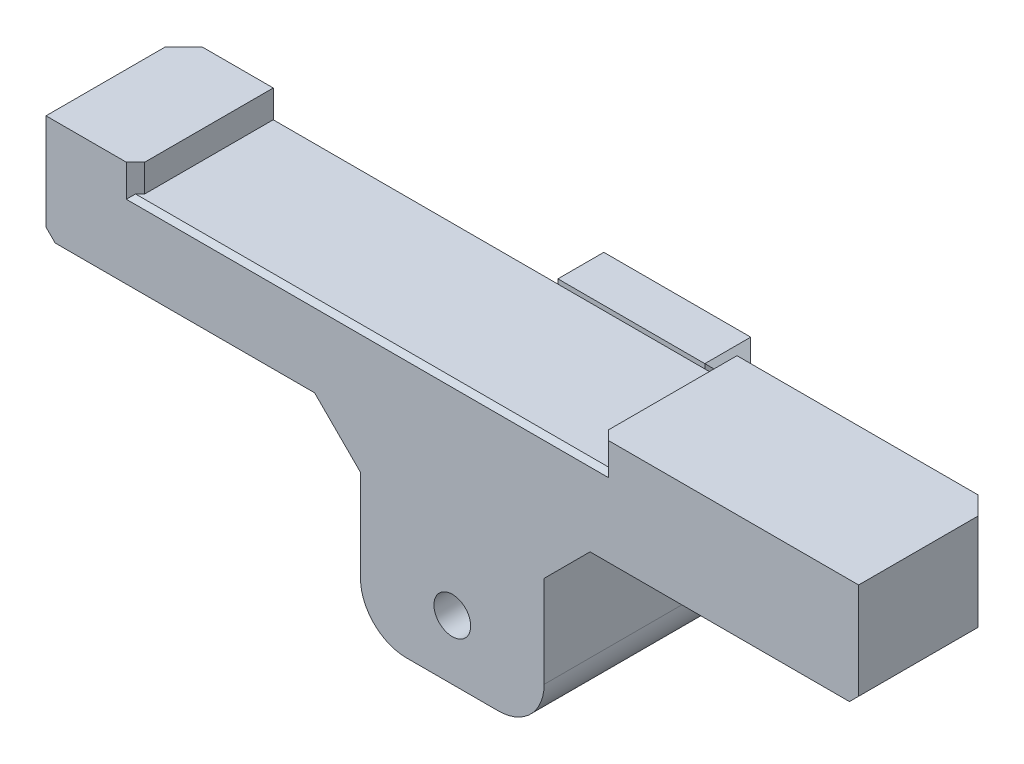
SolidWorks part; units mm, degrees
ref_plane "Ebene vorne" through (0, 0, 0) normal (0, 0, 1) x (1, 0, 0)
ref_plane "Ebene oben" through (0, 0, 0) normal (0, 1, 0) x (1, 0, 0)
ref_plane "Ebene rechts" through (0, 0, 0) normal (1, 0, 0) x (0, 0, -1)
sketch "Skizze1" plane through (0, 0, 0) normal (0, 0, 1) x (1, 0, 0)
  line L1 (-88.5, -11.5) -> (88.5, -11.5)
  line L2 (-88.5, -11.5) -> (-88.5, 11.5)
  line L3 (-88.5, 11.5) -> (88.5, 11.5)
  line L4 (88.5, -11.5) -> (88.5, 11.5)
  line L5 (-88.5, -11.5) -> (88.5, 11.5) construction
  line L6 (-88.5, 11.5) -> (88.5, -11.5) construction
  point P0 (0, 0)
  dimension "D1" = 177
  dimension "D2" = 23
extrude "Aufsatz-Linear austragen1" add sketch "Skizze1" along normal blind 30
sketch "Skizze3" plane through (0, 0, 0) normal (0, 0, -1) x (-1, 0, 0)
  line L0 (0, 0) -> (0, -39.7743) construction
  line L1 (88.5, -11.5) -> (-88.5, -11.5) construction
  line L2 (-20, -51.5) -> (20, -51.5)
  line L3 (0, -51.5) -> (0, -11.5)
  line L4 (-20, -11.5) -> (20, -11.5)
  line L5 (20, -51.5) -> (20, -11.5)
  line L6 (-20, -51.5) -> (-20, -11.5)
  dimension "D1" = 40
  dimension "D2" = 40
extrude "Aufsatz-Linear austragen2" add sketch "Skizze3" along normal blind 19 and the other way up to surface contours L6 L2 L3 M7 | L2 L5 L3 M7
sketch "Skizze4" plane through (0, -11.5, 0) normal (0, 1, 0) x (1, 0, 0)
  line L0 (-20, 0) -> (-20, 19) construction
  line L1 (20, 19) -> (-20, 19)
  line L2 (20, 19) -> (20, 9)
  line L3 (20, 9) -> (-20, 9)
  line L4 (-20, 19) -> (-20, 9)
  dimension "D1" = 10
extrude "Aufsatz-Linear austragen3" add sketch "Skizze4" along normal blind 9
chamfer "Fase1" distance 10 angle 45 2 edges at (20, -11.5, 15) (-20, -11.5, 15)
chamfer "Fase2" distance 4 angle 45 10 edges at (88.5, 0, 0) (-88.5, 0, 0) (20, -11.5, -4.5) (20, -7, -9) (20, -2.5, -14) (20, -27, -19) (-20, -27, -19) (-20, -2.5, -14) (-20, -11.5, -4.5) (-20, -7, -9)
sketch "Skizze9" plane through (0, 0, 0) normal (1, 0, 0) x (0, 0, -1)
  line L0 (9, -2.5) -> (9, -11.5) construction
  line L1 (0, -11.5) -> (9, -11.5)
  line L2 (0, -11.5) -> (0, -12.2)
  line L3 (0, -12.2) -> (9, -12.2)
  line L4 (9, -11.5) -> (9, -12.2)
  dimension "D1" = 0.7
extrude "Schnitt-Linear austragen5" cut sketch "Skizze9" against normal through all both and the other way through all
chamfer "Fase3" distance 2 angle 45 2 edges at (88.5, -11.5, 17) (-88.5, -11.5, 17)
sketch "Skizze6" plane through (0, 11.5, 0) normal (0, 1, 0) x (1, 0, 0)
  line L0 (0, -30) -> (0, 0) construction
  line L1 (88.5, -30) -> (-88.5, -30) construction
  line L2 (-6.9, -24) -> (-6.9, -17)
  line L3 (-6.9, -24) -> (6.9, -24)
  line L4 (0, -24) -> (0, -17)
  line L5 (-6.9, -17) -> (6.9, -17)
  line L6 (6.9, -24) -> (6.9, -17)
  dimension "D1" = 7
  dimension "D2" = 13.8
  dimension "D3" = 6
extrude "Schnitt-Linear austragen2" cut sketch "Skizze6" along normal blind 20 from surface at -63 contours L5 L2 L3 L4 | L3 L6 L5 L4
sketch "Skizze5" plane through (0, 0, 30) normal (0, 0, 1) x (1, 0, 0)
  line L0 (0, -51.5) -> (0, 11.5) construction
  line L1 (-20, -51.5) -> (20, -51.5) construction
  line L2 (88.5, 11.5) -> (-88.5, 11.5) construction
  circle A0 centre (0, -38.5) radius 4
  dimension "D2" = 8
  dimension "D1" = 50
extrude "Schnitt-Linear austragen1" cut sketch "Skizze5" against normal up to surface (13 mm away)
sketch "Skizze7" plane through (0, 0, 30) normal (0, 0, 1) x (1, 0, 0)
  line L0 (88.5, 11.5) -> (-88.5, 11.5) construction
  line L1 (-69, 11.5) -> (32, 11.5)
  line L2 (-69, 11.5) -> (-69, 5.5)
  line L3 (-69, 5.5) -> (32, 5.5)
  line L4 (32, 11.5) -> (32, 5.5)
  line L5 (-88.5, 11.5) -> (-88.5, -9.5) construction
  dimension "D1" = 19.5
  dimension "D2" = 101
  dimension "D3" = 6
extrude "Schnitt-Linear austragen3" cut sketch "Skizze7" against normal up to next
chamfer "Fase4" distance 2 angle 45 2 edges at (-69, 8.5, 30) (32, 8.5, 30)
chamfer "Fase5" distance 1 angle 45 1 edges at (-18.5, 5.5, 30)
fillet "Verrundung1" radius 10 2 edges at (-20, -51.5, 7.5) (20, -51.5, 7.5)
